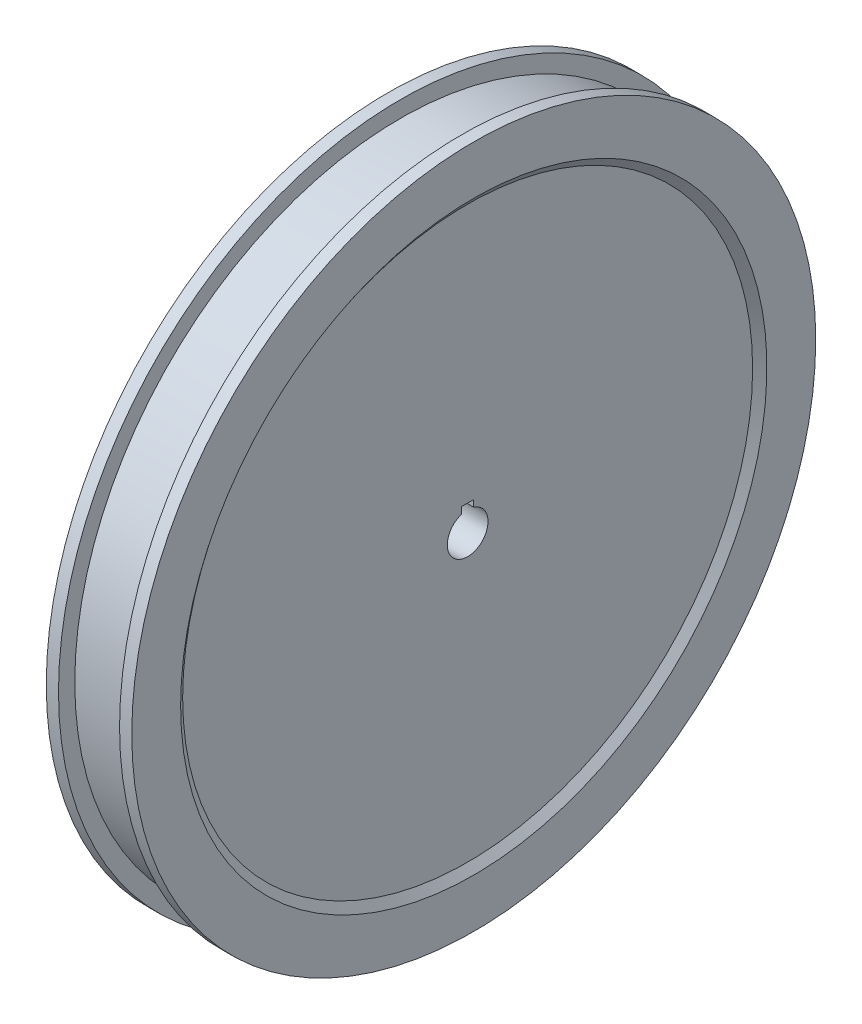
SolidWorks part; units mm, degrees
ref_plane "Plan de face" through (0, 0, 0) normal (0, 0, 1) x (1, 0, 0)
ref_plane "Plan de dessus" through (0, 0, 0) normal (0, 1, 0) x (1, 0, 0)
ref_plane "Plan de droite" through (0, 0, 0) normal (1, 0, 0) x (0, 0, -1)
sketch "Esquisse1" plane through (0, 0, 0) normal (0, 0, 1) x (1, 0, 0)
  line L0 (-9, 70) -> (-9, 5)
  line L1 (-10.5, 72) -> (-9, 70)
  line L2 (-10.5, 84) -> (-10.5, 72)
  line L3 (-7.5, 84) -> (-10.5, 84)
  line L4 (-7.5, 80) -> (-7.5, 84)
  line L5 (-7.5, 80) -> (7.5, 80)
  line L6 (7.5, 80) -> (7.5, 84)
  line L7 (7.5, 84) -> (10.5, 84)
  line L8 (10.5, 84) -> (10.5, 72)
  line L9 (10.5, 72) -> (9, 70)
  line L10 (9, 70) -> (9, 5)
  line L11 (9, 5) -> (-9, 5)
  line L12 (0, 0) -> (0, 30.7895) construction
  line L13 (0, 0) -> (22.6031, 0) construction
  point P1 (0, 5)
  point P17 (0, 80)
  dimension "D1" = 5
  dimension "D2" = 4
  dimension "D3" = 3
  dimension "D4" = 15
  dimension "D5" = 2
  dimension "D6" = 12
  dimension "D7" = 80
  dimension "D8" = 9
revolve "Révolution1" add sketch "Esquisse1" angle 360 about L13
sketch "Esquisse3" plane through (-9, 0, 0) normal (-1, 0, 0) x (0, 0, 1)
  line L0 (0, 0) -> (0, 19.6491) construction
  line L2 (-1.5, 6.4) -> (1.5, 6.4)
  line L3 (-1.5, 6.4) -> (-1.5, 0)
  line L4 (-1.5, 0) -> (1.5, 0)
  line L5 (1.5, 6.4) -> (1.5, 0)
  dimension "D1" = 3
  dimension "D2" = 1.5
  dimension "D3" = 6.4
extrude "Enlèv. mat.-Extru.1" cut sketch "Esquisse3" against normal through all
